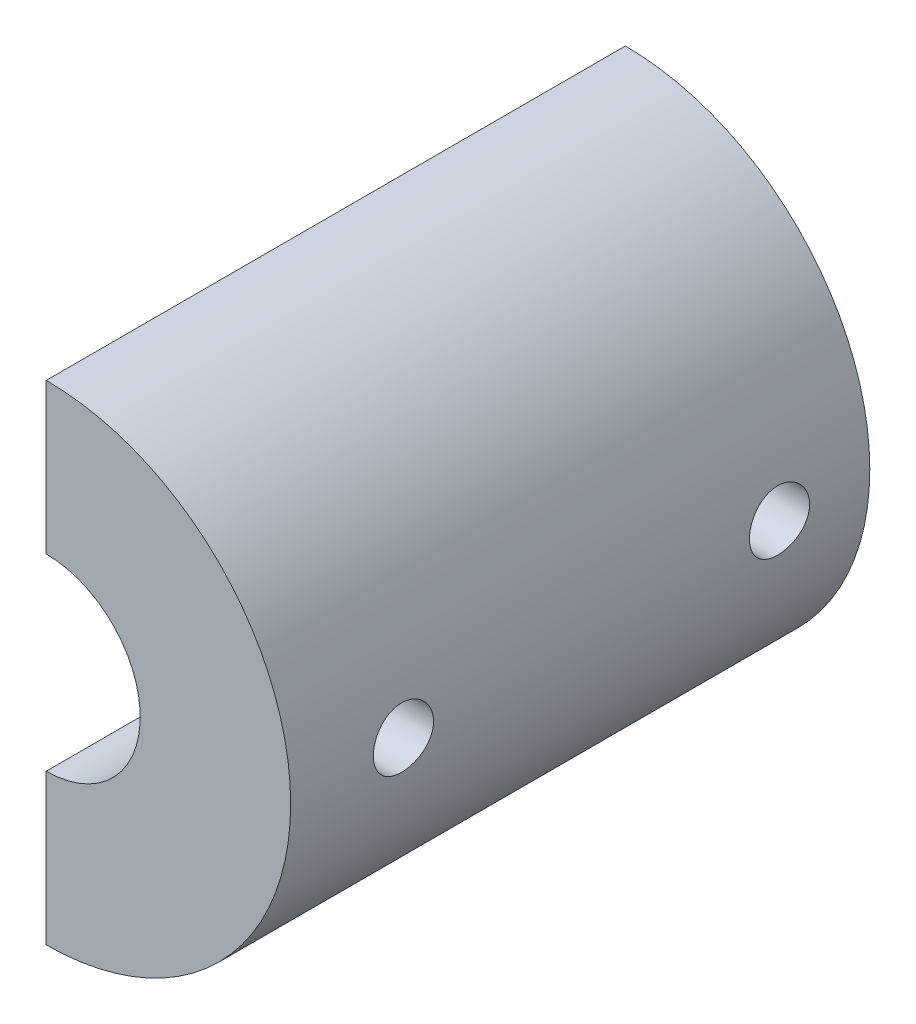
SolidWorks part; units mm, degrees
ref_plane "Plan1" through (0, 0, 0) normal (0, 0, 1) x (1, 0, 0)
ref_plane "Plan2" through (0, 0, 0) normal (0, 1, 0) x (1, 0, 0)
ref_plane "Plan3" through (0, 0, 0) normal (1, 0, 0) x (0, 0, -1)
sketch "Esquisse1" plane through (0, 0, 0) normal (0, 0, 1) x (1, 0, 0)
  line L0 (0, 12.5) -> (0, 32.5)
  line L1 (0, -12.5) -> (0, -32.5)
  circle A0 centre (0, 0) radius 12.5 construction
  arc A1 (0, -12.5) -> (0, 12.5) centre (0, 0) ccw
  arc A2 (0, -32.5) -> (0, 32.5) centre (0, 0) ccw
  dimension "D1" = 20
extrude "Base-Extrusion" add sketch "Esquisse1" along normal blind 77
sketch "Esquisse2" plane through (0, 0, 0) normal (-1, 0, 0) x (0, 0, 1)
  line L0 (235, 0) -> (-424, 0) construction
  line L1 (77, 32.5) -> (77, 12.5) construction
  circle A0 centre (62, 0) radius 4
  circle A1 centre (12, 0) radius 4
  dimension "D1" = 8
  dimension "D2" = 50
  dimension "D3" = 15
extrude "Enlèv. mat.-Extru.1" cut sketch "Esquisse2" against normal blind 80
